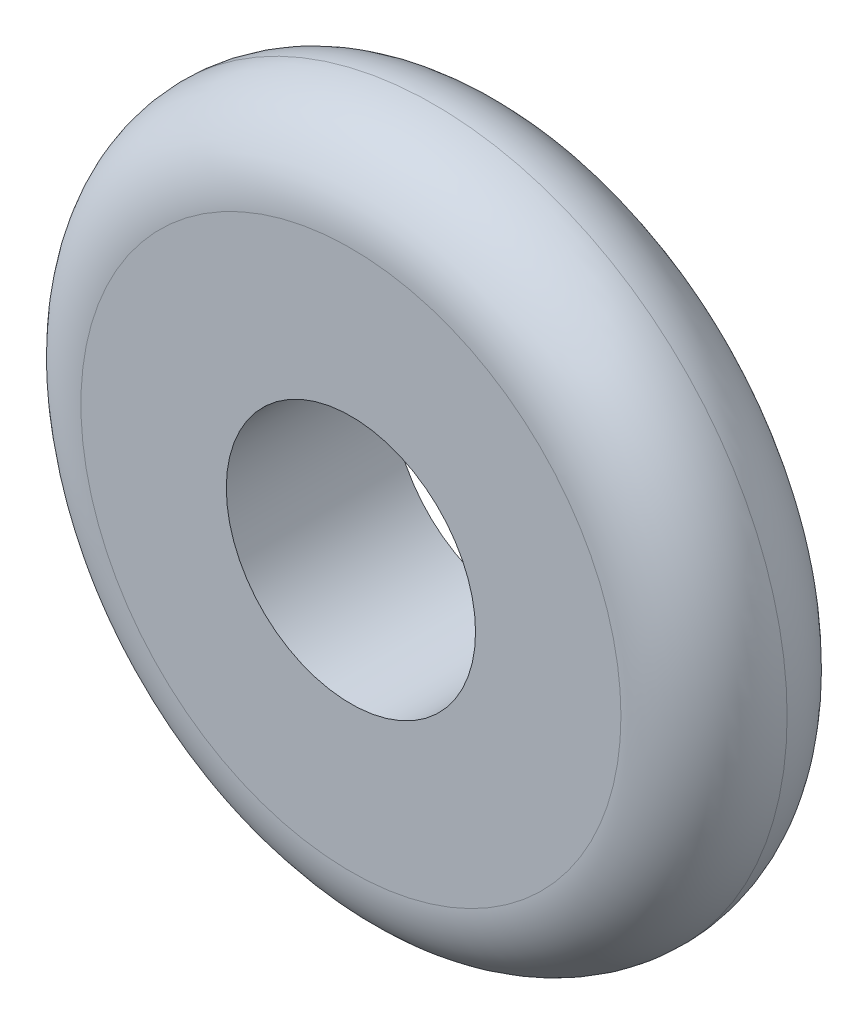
SolidWorks part; units mm, degrees
ref_plane "Plan de face" through (0, 0, 0) normal (0, 0, 1) x (1, 0, 0)
ref_plane "Plan de dessus" through (0, 0, 0) normal (0, 1, 0) x (1, 0, 0)
ref_plane "Plan de droite" through (0, 0, 0) normal (1, 0, 0) x (0, 0, -1)
sketch "Esquisse1" plane through (0, 0, 0) normal (0, 0, 1) x (1, 0, 0)
  circle A0 centre (0, 0) radius 8.5
  circle A1 centre (0, 0) radius 3
  dimension "D1" = 17
  dimension "D2" = 6
extrude "Extrusion1" add sketch "Esquisse1" along normal blind 4
fillet "Congé1" radius 2 2 edges at (8.5, 0, 0) (8.5, 0, 4)
